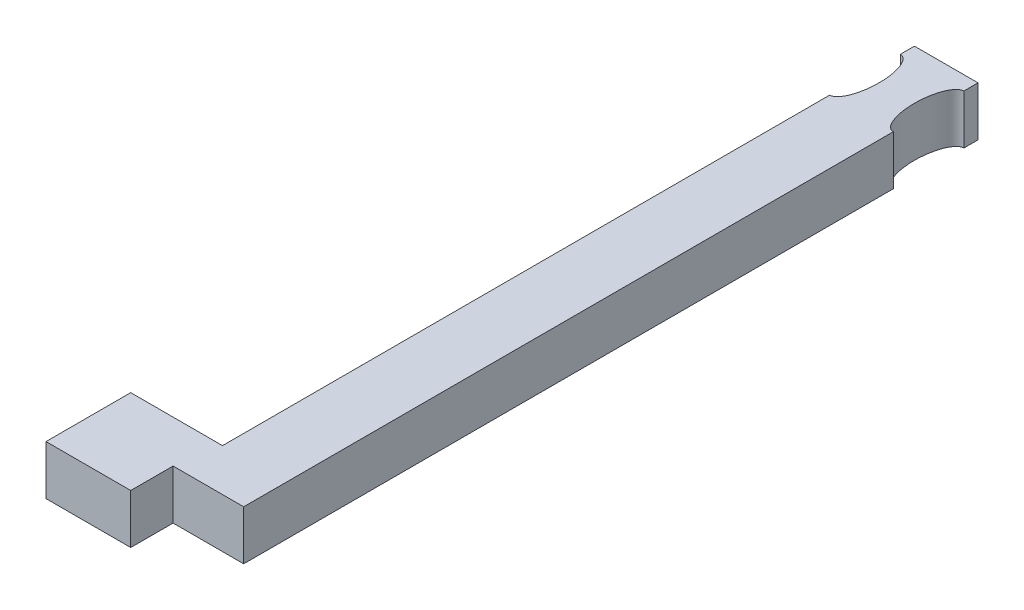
SolidWorks part; units mm, degrees
ref_plane "Plan de face" through (0, 0, 0) normal (0, 0, 1) x (1, 0, 0)
ref_plane "Plan de dessus" through (0, 0, 0) normal (0, 1, 0) x (1, 0, 0)
ref_plane "Plan de droite" through (0, 0, 0) normal (1, 0, 0) x (0, 0, -1)
sketch "Esquisse1" plane through (0, 0, 0) normal (0, 1, 0) x (1, 0, 0)
  line L0 (-3.3452, 0) -> (28.6459, 0) construction
  line L1 (0, -3.2572) -> (0, 12.6712) construction
  line L2 (6, -3.2572) -> (6, 11.0064) construction
  line L3 (-3.3452, 6) -> (17.1156, 6) construction
  line L4 (6.5, 53.9166) -> (6.5, 7.6443) construction
  line L5 (11, 53.9166) -> (11, 3.8746) construction
  line L6 (19.9859, 3) -> (2.8696, 3) construction
  line L7 (28.6459, 55) -> (2.8696, 55) construction
  line L8 (3, 12.6712) -> (3, 2.9746) construction
  line L9 (4.5, 16.1985) -> (4.5, 2.625) construction
  line L10 (6, 3) -> (11, 3)
  line L11 (6.5, 55) -> (11, 55)
  line L12 (6.5, 55) -> (6.5, 54)
  line L13 (2.8696, 54) -> (14.8728, 54) construction
  line L14 (11, 55) -> (11, 54)
  line L15 (0, 0) -> (6, 0)
  line L16 (0, 0) -> (0, 6)
  line L17 (0, 6) -> (6.5, 6)
  line L18 (6, 0) -> (6, 3)
  line L19 (2.8696, 49) -> (14.8728, 49) construction
  line L20 (10, 49.2536) -> (10, 38.7134) construction
  line L22 (12.0803, 51.5) -> (9.4985, 51.5) construction
  line L23 (11, 49) -> (11, 3)
  line L24 (6.5, 49) -> (6.5, 6)
  ellipse E0 centre (11, 51.5) end of major axis (11, 54) minor radius 1 (11, 54) -> (11, 49) ccw
  ellipse E1 centre (6.5, 51.5) end of major axis (6.5, 54) minor radius 1 (6.5, 54) -> (6.5, 49) cw
  dimension "D1" = 6
  dimension "D2" = 3
  dimension "D3" = 6
  dimension "D4" = 4.5
  dimension "D5" = 3
  dimension "D6" = 1.5
  dimension "D7" = 2
  dimension "D8" = 49
  dimension "D9" = 1
  dimension "D10" = 5
  dimension "D11" = 2.5
  dimension "D12" = 1
extrude "Boss.-Extru.1" add sketch "Esquisse1" along normal blind 3.5
sketch "Esquisse2" plane through (0, 0, 0) normal (0, -1, 0) x (1, 0, 0)
  line L0 (3, 0) -> (3, -7.5555) construction
  line L1 (8.6244, -3) -> (-0.4666, -3) construction
  line L2 (8.6244, 0) -> (-0.7088, 0) construction
  line L3 (0, 0) -> (6, 0) construction
  line L4 (0, -6) -> (0, 0) construction
  line L5 (1.3, -1.3) -> (4.7, -1.3)
  line L6 (1.3, -1.3) -> (1.3, -4.7)
  line L7 (1.3, -4.7) -> (4.7, -4.7)
  line L8 (4.7, -1.3) -> (4.7, -4.7)
  line L9 (1.3, -1.3) -> (4.7, -4.7) construction
  line L10 (1.3, -4.7) -> (4.7, -1.3) construction
  point P8 (3, -3)
  dimension "D1" = 3
extrude "Enlèv. mat.-Extru.1" cut sketch "Esquisse2" against normal blind 2.5
